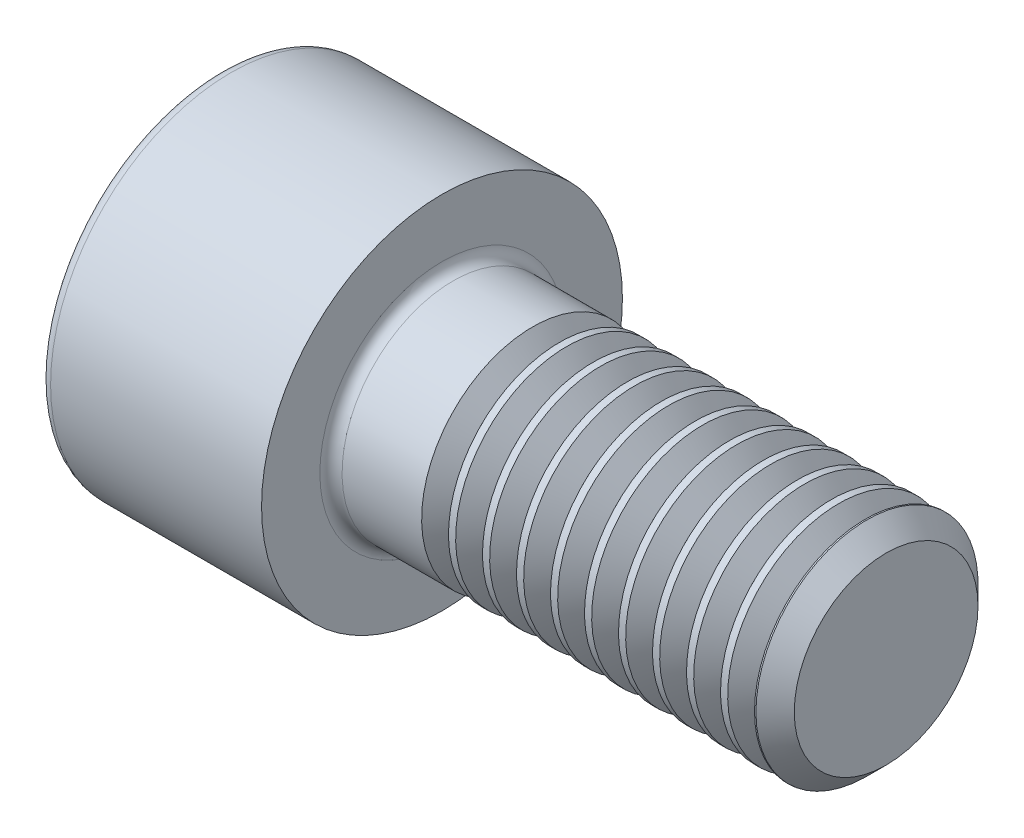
SolidWorks part; units mm, degrees
ref_plane "Plane1" through (0, 0, 0) normal (0, 0, 1) x (1, 0, 0)
ref_plane "Plane2" through (0, 0, 0) normal (0, 1, 0) x (1, 0, 0)
ref_plane "Plane3" through (0, 0, 0) normal (1, 0, 0) x (0, 0, -1)
sketch "BodySke" plane through (0, 0, 0) normal (0, 0, 1) x (1, 0, 0)
  line L0 (0, 0) -> (0, 6.5)
  line L1 (0, 6.5) -> (8, 6.5)
  line L2 (8, 6.5) -> (8, 4)
  line L3 (8, 4) -> (23.3095, 4)
  line L4 (24, 3.3095) -> (24, 0)
  line L5 (24, 0) -> (0, 0)
  line L6 (-31.75, 0) -> (127, 0) construction
  line L8 (24, 3.3095) -> (23.3095, 4)
  line L10 (24, -3.3095) -> (23.3095, -4) construction
  line L11 (9.25, 9.525) -> (9.25, 3.175) construction
  line L12 (8, 9.525) -> (8, 3.175) construction
  line L13 (-36, 9.525) -> (-36, 3.175) construction
  dimension "Diameter" = 8
  dimension "Head_ht" = 8
  dimension "Length" = 16
  dimension "Body_ch_ang" = 45
  dimension "Head_dia" = 13
  dimension "Minor_dia" = 6.619
  dimension "Advance" = 1.25
  dimension "Thread_nom" = 16
  dimension "Thread_length" = 60
revolve "Base-Revolve" add sketch "BodySke"
fillet "Fillet1" radius 0.4 1 edges at (8, 0, 4)
fillet "Fillet2" radius 0.4 1 edges at (0, 0, 6.5)
sketch "Sketch2" plane through (0, 0, 0) normal (0, 0, 1) x (1, 0, 0)
  line L0 (0, 3.0475) -> (4, 3.0475)
  line L1 (4, 3.0475) -> (5.7595, 0)
  line L2 (-31.75, 0) -> (127, 0) construction
  line L3 (5.7595, 0) -> (0, 0)
  line L4 (0, 0) -> (0, 3.0475)
  line L6 (0, 0) -> (47.625, 0) construction
  dimension "D1" = 3.0475
  dimension "D2" = 60
  dimension "Depth" = 4
revolve "Hex-PreBroach" cut sketch "Sketch2" angle 360 about L6
sketch "Sketch3" plane through (0, 0, 0) normal (-1, 0, 0) x (0, 0.5, 0.866)
  line L0 (1.7595, 3.0475) -> (-1.7595, 3.0475)
  line L1 (-1.7595, 3.0475) -> (-3.5189, 0)
  line L2 (1.7595, 3.0475) -> (3.5189, 0)
  line L3 (1.7595, -3.0475) -> (3.5189, 0)
  line L4 (1.7595, -3.0475) -> (-1.7595, -3.0475)
  line L5 (-1.7595, -3.0475) -> (-3.5189, 0)
  dimension "D1" = 3.0475
  dimension "D2" = 3.0475
  dimension "Hex_size" = 6.095
extrude "Hex" cut sketch "Sketch3" against normal blind 4
sketch "ThdSchSke" plane through (0, 0, 0) normal (0, 0, 1) x (1, 0, 0)
  line L0 (11.75, -3.3095) -> (11.2665, -4)
  line L1 (11.75, -3.3095) -> (12.2335, -4)
  line L2 (12.2335, -4) -> (12.2335, -5)
  line L3 (-3.175, 0) -> (5.1513, 0) construction
  line L4 (0, 6.1) -> (0, -6.1) construction
  line L5 (12.2335, -5) -> (11.2665, -5)
  line L6 (11.2665, -5) -> (11.2665, -4)
  dimension "Thread_minor" = 6.619
  dimension "Diameter" = 8
  dimension "Start" = 11.75
  dimension "SideAngle" = 55
  dimension "VeeAngle" = 70
  dimension "Overcut" = 10
revolve "ThreadSchematic" cut sketch "ThdSchSke" angle 360 about L3
pattern_linear "ThdSchPat" count 10 spacing 1.225 along (1, 0, 0) of "ThreadSchematic"
equation "\"D2@Sketch3\" = \"Hex_size@Sketch3\" / 2"
equation "\"D1@Sketch3\" = \"Hex_size@Sketch3\" / 2"
equation "\"D1@Sketch2\" = \"Hex_size@Sketch3\" / 2"
equation "\"Thread_minor@ThreadCosmetic\"  =  \"Minor_dia@BodySke\""
equation "\"Depth@Sketch2\" =  \"Key_eng@Hex\""
equation "\"Thread_length@ThreadCosmetic\" = ((sgn( (\"Length@BodySke\" - \"Advance@BodySke\" * 3.0) - \"Thread_nom@BodySke\" )-1)*( (\"Length@BodySke\" - \"Advance@BodySke\" * 3.0) - \"Thread_nom@BodySke\" ))/-2+ \"Thread_no"
equation "\"Thread_minor@ThdSchSke\" = \"Minor_dia@BodySke\""
equation "\"Diameter@ThdSchSke\" = \"Diameter@BodySke\""
equation "\"Overcut@ThdSchSke\" = \"Diameter@BodySke\" * 1.25"
equation "\"Start@ThdSchSke\" = \"Head_ht@BodySke\" + \"Length@BodySke\" - \"Thread_length@ThreadCosmetic\"  '---Non-countersunk---"
equation "\"Num_threads@ThdSchPat\" = int( \"Thread_length@ThreadCosmetic\" / \"Advance@BodySke\" + 0.999 )  + 1"
equation "\"Advance@ThdSchPat\" = \"Thread_length@ThreadCosmetic\" /  (\"Num_threads@ThdSchPat\" - 1) 'relax it"
equation "\"Num_threads@ThdSchPat\" = \"Num_threads@ThdSchPat\" - sgn( \"Num_threads@ThdSchPat\" - 1) '---chamfered tips only---"
